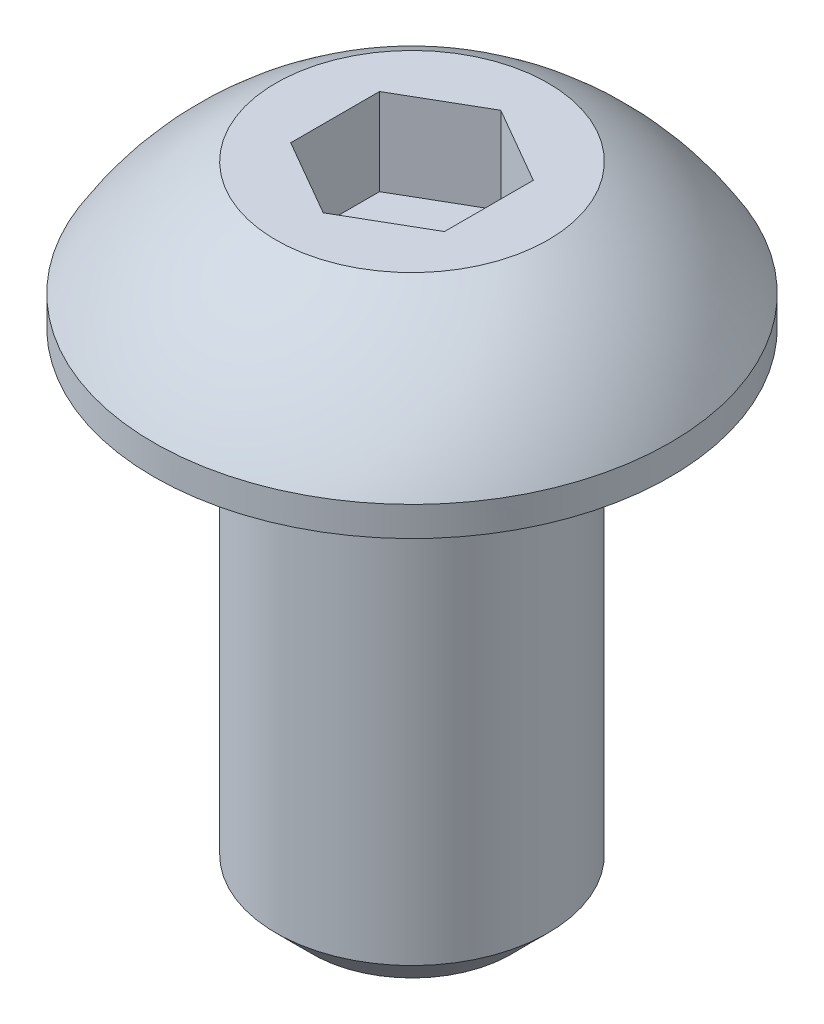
SolidWorks part; units mm, degrees
ref_plane "Front" through (0, 0, 0) normal (0, 0, 1) x (1, 0, 0)
ref_plane "Top" through (0, 0, 0) normal (0, 1, 0) x (1, 0, 0)
ref_plane "Right" through (0, 0, 0) normal (1, 0, 0) x (0, 0, -1)
revolve "Boss-Revolve1" add sketch "Sketch2"
sketch "Sketch2" plane through (0, 0, 0) normal (0, 0, 1) x (1, 0, 0)
  line L0 (0, 0) -> (0, 100) construction
  line L1 (0, -6.35) -> (1.2802, -6.35)
  line L2 (1.2802, -6.35) -> (1.7526, -5.8776)
  line L3 (1.7526, -5.8776) -> (1.7526, 0)
  line L4 (1.7526, 0) -> (0, 0)
  line L5 (0, 0) -> (0, -6.35)
revolve "Base-Revolve" add sketch "Sketch1" angle 360 about L4
sketch "Sketch1" plane through (0, 0, 0) normal (0, 0, 1) x (1, 0, 0)
  line L0 (0, 0) -> (3.3274, 0)
  line L1 (3.3274, 0) -> (3.3274, 0.381)
  line L2 (1.7526, 1.8542) -> (0, 1.8542)
  line L3 (0, 1.8542) -> (0, 0)
  line L4 (0, 0) -> (0, 100) construction
  arc A0 (3.3274, 0.381) -> (1.7526, 1.8542) centre (0, -1.5976) ccw
ref_plane "Plane4" through (0, 1.8542, 0) normal (0, 1, 0) x (-1, 0, 0)
sketch "Sketch3" plane through (0, 1.8542, 0) normal (0, 1, 0) x (-1, 0, 0)
  line L0 (0.9906, 0.5719) -> (0, 1.1438)
  line L1 (0, 1.1438) -> (-0.9906, 0.5719)
  line L2 (-0.9906, 0.5719) -> (-0.9906, -0.5719)
  line L3 (-0.9906, -0.5719) -> (0, -1.1438)
  line L4 (0, -1.1438) -> (0.9906, -0.5719)
  line L5 (0.9906, -0.5719) -> (0.9906, 0.5719)
extrude "Cut-Extrude1" cut sketch "Sketch3" against normal blind 1.1176
